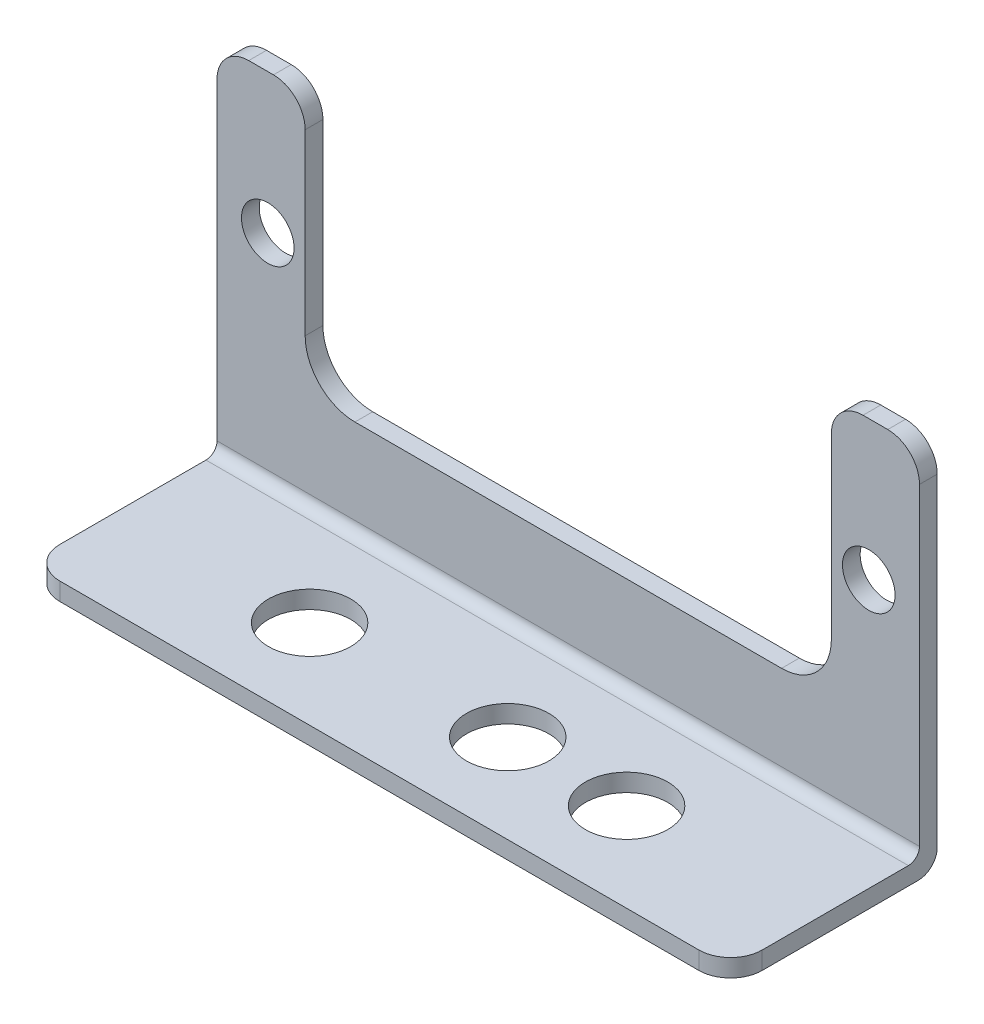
SolidWorks part; units mm, degrees
ref_plane "Front Plane" through (0, 0, 0) normal (0, 0, 1) x (1, 0, 0)
ref_plane "Top Plane" through (0, 0, 0) normal (0, 1, 0) x (1, 0, 0)
ref_plane "Right Plane" through (0, 0, 0) normal (1, 0, 0) x (0, 0, -1)
sketch "Sketch1" plane through (0, 0, 0) normal (1, 0, 0) x (0, 0, -1)
  line L0 (-1.524, 0) -> (-16.5608, 0)
  line L1 (-16.5608, 0) -> (-16.5608, 1.4224)
  line L2 (0, 1.524) -> (0, 29.972)
  line L3 (0, 29.972) -> (-1.4224, 29.972)
  line L4 (-16.5608, 1.4224) -> (-2.3114, 1.4224)
  line L5 (-1.4224, 29.972) -> (-1.4224, 2.3114)
  arc A0 (-2.3114, 1.4224) -> (-1.4224, 2.3114) centre (-2.3114, 2.3114) ccw
  arc A1 (0, 1.524) -> (-1.524, 0) centre (-1.524, 1.524) cw
  point P11 (0, 0)
  dimension "D1" = 0.889
  dimension "D2" = 1.524
extrude "Boss-Extrude1" add sketch "Sketch1" along normal blind 56.2864
sketch "Sketch2" plane through (0, 0, 1.4224) normal (0, 0, 1) x (1, 0, 0)
  circle A0 centre (4.064, 18.7706) radius 1.9939
  circle A1 centre (52.2224, 18.7706) radius 1.9939
sketch "Sketch3" plane through (0, 1.4224, 0) normal (0, 1, 0) x (1, 0, 0)
  circle A0 centre (15.4432, -9.4488) radius 3.302
  circle A1 centre (40.8432, -9.4488) radius 3.302
  circle A2 centre (31.3182, -9.4488) radius 3.302
extrude "Cut-Extrude2" cut sketch "Sketch3" against normal through all
sketch "Sketch4" plane through (0, 0, 1.4224) normal (0, 0, 1) x (1, 0, 0)
  line L1 (56.2864, 29.972) -> (0, 29.972) construction
  line L2 (28.1432, 9.144) -> (11.049, 9.144)
  line L3 (7.0612, 13.1318) -> (7.0612, 29.972)
  line L4 (7.0612, 29.972) -> (49.2252, 29.972)
  line L5 (49.2252, 29.972) -> (49.2252, 13.1318)
  line L6 (45.2374, 9.144) -> (28.1432, 9.144)
  arc A0 (49.2252, 13.1318) -> (45.2374, 9.144) centre (45.2374, 13.1318) cw
  arc A1 (11.049, 9.144) -> (7.0612, 13.1318) centre (11.049, 13.1318) cw
  dimension "D1" = 3.9878
extrude "Cut-Extrude3" cut sketch "Sketch4" against normal through all
fillet "Fillet1" radius 2.54 4 edges at (56.2864, 29.972, 0.7112) (7.0612, 29.972, 0.7112) (49.2252, 29.972, 0.7112) (0, 29.972, 0.7112)
fillet "Fillet2" radius 2.54 2 edges at (56.2864, 0.7112, 16.5608) (0, 0.7112, 16.5608)
sketch "Sketch6" plane through (0, 0, 1.4224) normal (0, 0, 1) x (1, 0, 0)
  circle A0 centre (4.064, 18.7706) radius 2.1082
  circle A1 centre (52.2224, 18.7706) radius 2.1082
extrude "Cut-Extrude4" cut sketch "Sketch6" against normal through all
